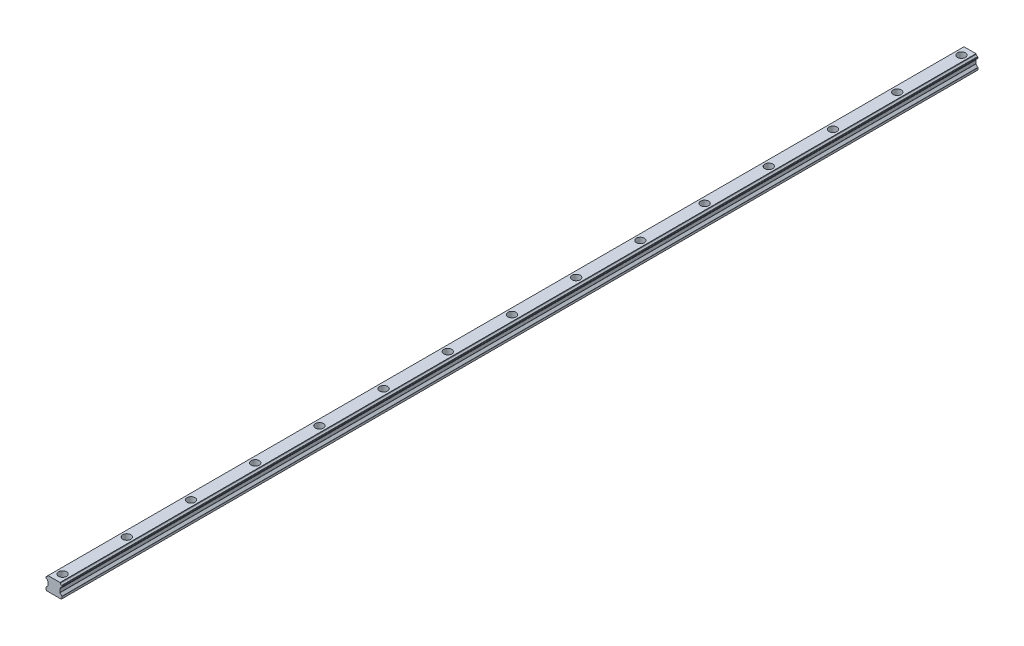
SolidWorks part; units mm, degrees
other "linear_guideway_rails_tr15rh25008"
ref_plane "Front" through (0, 0, 0) normal (0, 0, 1) x (1, 0, 0)
ref_plane "Top" through (0, 0, 0) normal (0, 1, 0) x (1, 0, 0)
ref_plane "Right" through (0, 0, 0) normal (1, 0, 0) x (0, 0, -1)
imported_body "Importée1"
sketch "Esquisse1" plane through (0, 13, 0) normal (0, 1, 0) x (1, 0, 0)
  line L0 (-7.5, 2500) -> (-7.5, 0) construction
  line L1 (7.5, 2500) -> (-7.5, 2500)
  line L2 (7.5, 2500) -> (7.5, 856)
  line L3 (7.5, 856) -> (-7.5, 856)
  line L4 (-7.5, 2500) -> (-7.5, 856)
  line L6 (5.6, 0) -> (-5.6, 0) construction
  dimension "D1" = 856
extrude "Enlèv. mat.-Extru.1" cut sketch "Esquisse1" against normal through all
